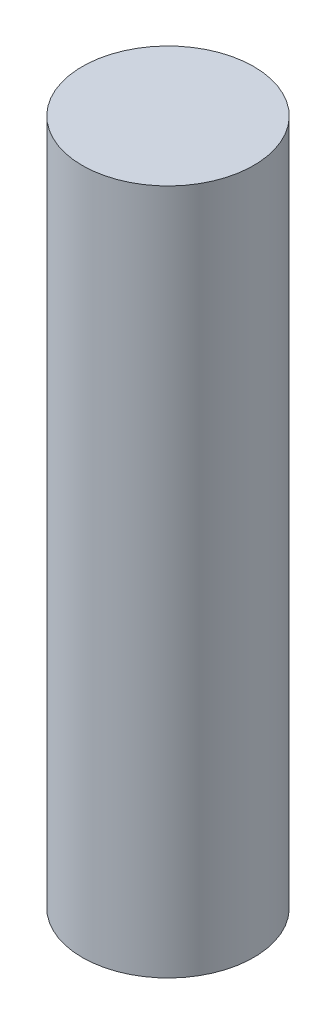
SolidWorks part; units mm, degrees
ref_plane "Front Plane" through (0, 0, 0) normal (0, 0, 1) x (1, 0, 0)
ref_plane "Top Plane" through (0, 0, 0) normal (0, 1, 0) x (1, 0, 0)
ref_plane "Right Plane" through (0, 0, 0) normal (1, 0, 0) x (0, 0, -1)
sketch "Sketch1" plane through (0, 0, 0) normal (0, 1, 0) x (1, 0, 0)
  circle A0 centre (0, 0) radius 1.5875
  dimension "D1" = 3.175
extrude "Boss-Extrude1" add sketch "Sketch1" along normal mid plane 12.7
